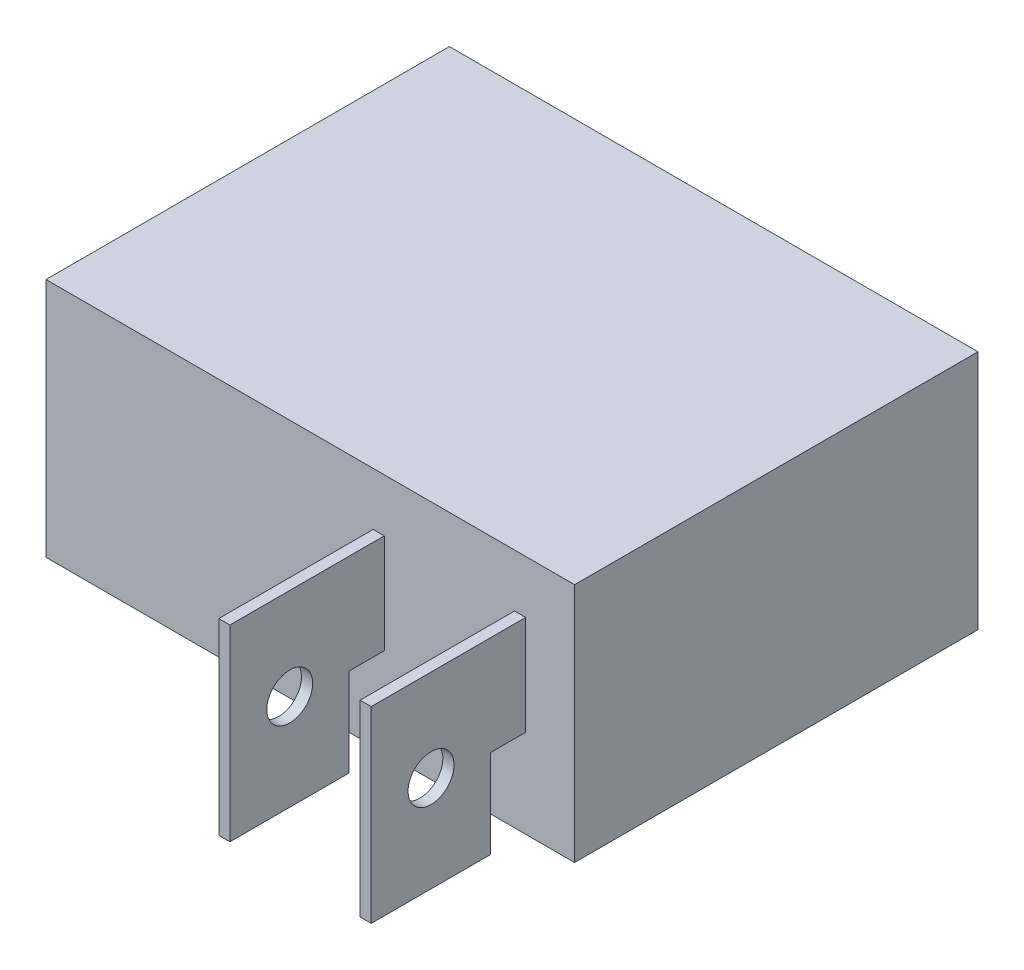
SolidWorks part; units mm, degrees
ref_plane "Front Plane" through (0, 0, 0) normal (0, 0, 1) x (1, 0, 0)
ref_plane "Top Plane" through (0, 0, 0) normal (0, 1, 0) x (1, 0, 0)
ref_plane "Right Plane" through (0, 0, 0) normal (1, 0, 0) x (0, 0, -1)
sketch "Sketch1" plane through (0, 0, 0) normal (0, 1, 0) x (1, 0, 0)
  line L1 (-19, -14.5) -> (19, -14.5)
  line L2 (-19, -14.5) -> (-19, 14.5)
  line L3 (-19, 14.5) -> (19, 14.5)
  line L4 (19, -14.5) -> (19, 14.5)
  line L5 (-19, -14.5) -> (19, 14.5) construction
  line L6 (-19, 14.5) -> (19, -14.5) construction
  point P0 (0, 0)
  dimension "D1" = 38
  dimension "D2" = 29
extrude "Boss-Extrude1" add sketch "Sketch1" along normal blind 17.3
ref_plane "Plane1" through (4.92, 0, 0) normal (-1, 0, 0) x (0, 0, 1)
sketch "Sketch2" plane through (4.92, 0, 0) normal (-1, 0, 0) x (0, 0, 1)
  line L0 (14.5, 13.5) -> (25.6, 13.5)
  line L1 (14.5, 17.3) -> (14.5, 0) construction
  line L2 (25.6, 13.5) -> (25.6, 0)
  line L3 (25.6, 0) -> (17.03, 0)
  line L4 (17.03, 0) -> (17.03, 6.35)
  line L5 (17.03, 6.35) -> (14.5, 6.35)
  line L6 (-14.5, 17.3) -> (-14.5, 0) construction
  line L7 (14.5, 0) -> (-14.5, 0) construction
  line L8 (14.5, 13.5) -> (14.5, 6.35)
  circle A0 centre (21.3, 6.9) radius 1.65
  dimension "D1" = 13.5
  dimension "D2" = 3.3
  dimension "D3" = 35.8
  dimension "D4" = 6.9
  dimension "D5" = 40.1
  dimension "D6" = 31.53
  dimension "D7" = 6.35
extrude "Boss-Extrude2" add sketch "Sketch2" along normal mid plane 0.8
pattern_linear "LPattern1" count 2 spacing 10.16 along (1, 0, 0) of "Boss-Extrude2"
